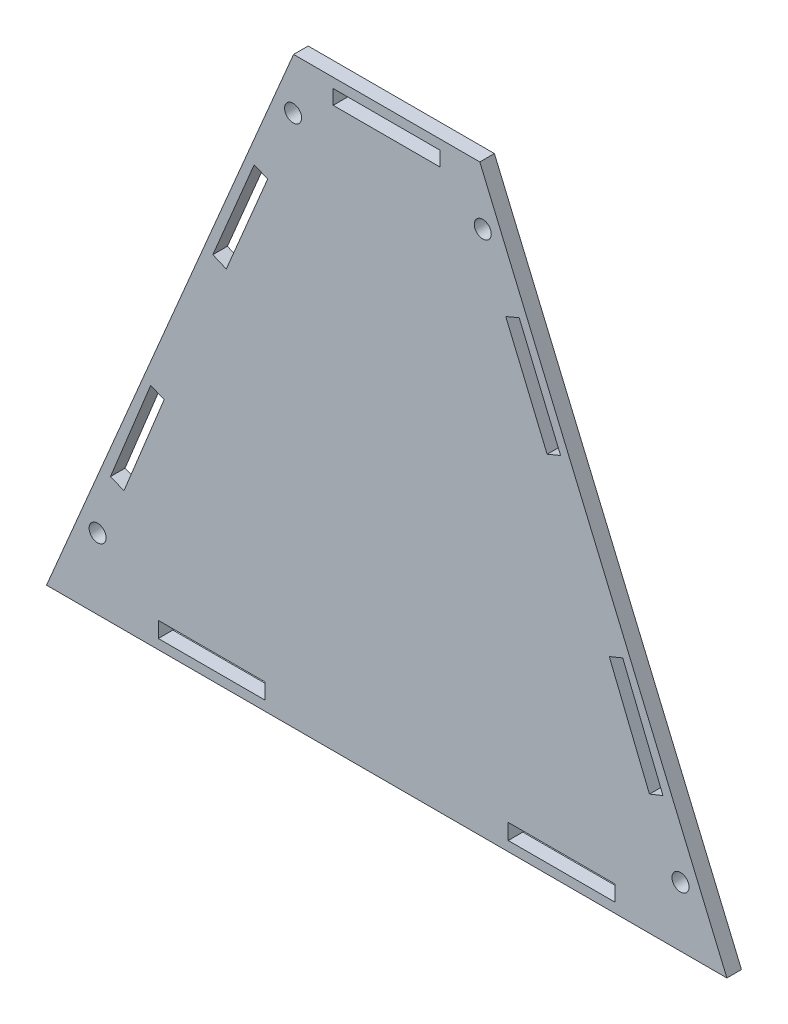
SolidWorks part; units mm, degrees
ref_plane "Front Plane" through (0, 0, 0) normal (0, 0, 1) x (1, 0, 0)
ref_plane "Top Plane" through (0, 0, 0) normal (0, 1, 0) x (1, 0, 0)
ref_plane "Right Plane" through (0, 0, 0) normal (1, 0, 0) x (0, 0, -1)
sketch "Sketch1" plane through (0, 0, 0) normal (0, 0, 1) x (1, 0, 0)
  line L0 (70, 24.2109) -> (70, -66.5) construction
  line L1 (50.8389, 53.5) -> (89.1611, 53.5)
  line L2 (50.8389, 53.5) -> (0, -66.5)
  line L3 (0, -66.5) -> (140, -66.5)
  line L4 (89.1611, 53.5) -> (140, -66.5)
  dimension "D1" = 140
  dimension "D2" = 35
  dimension "D3" = 35
  dimension "D4" = 120
extrude "Boss-Extrude1" add sketch "Sketch1" along normal blind 3
sketch "Sketch2" plane through (0, 0, 0) normal (0, 0, -1) x (-1, 0, 0)
  line L0 (-140, -66.5) -> (-89.1611, 53.5) construction
  line L1 (-50.8389, 53.5) -> (0, -66.5) construction
  circle A0 centre (-130.4513, -54.2153) radius 1.75
  circle A1 centre (-89.764, 41.8229) radius 1.75
  circle A2 centre (-50.736, 43.0033) radius 1.75
  circle A3 centre (-10.5104, -51.9453) radius 1.75
  dimension "D1" = 3.5
  dimension "D2" = 3.5
  dimension "D3" = 3.5
  dimension "D4" = 3.5
  dimension "D5" = 4
  dimension "D6" = 4
  dimension "D7" = 4
  dimension "D8" = 4
extrude "Cut-Extrude1" cut sketch "Sketch2" against normal blind 6
sketch "Sketch4" plane through (0, 0, 0) normal (0, 0, -1) x (-1, 0, 0)
  line L0 (-70, 53.5) -> (-70, 45.1795) construction
  line L1 (-80.9814, 51.5) -> (-58.9814, 51.5)
  line L2 (-80.9814, 51.5) -> (-80.9814, 48.5)
  line L3 (-80.9814, 48.5) -> (-58.9814, 48.5)
  line L4 (-58.9814, 51.5) -> (-58.9814, 48.5)
  line L5 (-89.1611, 53.5) -> (-50.8389, 53.5) construction
  line L6 (-69.9814, 51.5) -> (-69.9814, 48.5) construction
  line L7 (-94.4948, 28.6252) -> (-103.0118, 8.3407)
  line L8 (-115.7892, -21.3141) -> (-124.063, -41.699)
  line L9 (-97.2608, 29.7866) -> (-105.7779, 9.5021)
  line L10 (-118.5689, -20.1858) -> (-126.8428, -40.5707)
  line L11 (-126.8428, -40.5707) -> (-124.063, -41.699)
  line L12 (-118.5689, -20.1858) -> (-115.7892, -21.3141)
  line L13 (-115.7892, -21.3141) -> (-115.8086, -21.3391)
  line L14 (-105.7779, 9.5021) -> (-103.0118, 8.3407)
  line L15 (-97.2608, 29.7866) -> (-94.4948, 28.6252)
  line L16 (-70, 57.0835) -> (-70, -66.5) construction
  line L17 (0, -66.5) -> (-140, -66.5) construction
  line L18 (-13.1572, -40.5707) -> (-15.937, -41.699)
  line L19 (-24.2108, -21.3141) -> (-15.937, -41.699)
  line L20 (-21.4311, -20.1858) -> (-24.2108, -21.3141)
  line L21 (-21.4311, -20.1858) -> (-13.1572, -40.5707)
  line L22 (-34.2221, 9.5021) -> (-36.9882, 8.3407)
  line L23 (-42.7392, 29.7866) -> (-45.5052, 28.6252)
  line L24 (-42.7392, 29.7866) -> (-34.2221, 9.5021)
  line L25 (-45.5052, 28.6252) -> (-36.9882, 8.3407)
  line L26 (-113.5989, -52.6823) -> (-113.5989, -61.0028) construction
  line L27 (-117, -61.2694) -> (-95, -61.2694)
  line L28 (-117, -61.2694) -> (-117, -64.5)
  line L29 (-117, -64.5) -> (-95, -64.5)
  line L30 (-95, -61.2694) -> (-95, -64.5)
  line L31 (-106, -61.2694) -> (-106, -64.5) construction
  line L32 (-140, -66.5) -> (-89.1611, 53.5) construction
  line L33 (-23, -61.2694) -> (-23, -64.5)
  line L34 (-23, -64.5) -> (-45, -64.5)
  line L35 (-23, -61.2694) -> (-45, -61.2694)
  line L36 (-45, -61.2694) -> (-45, -64.5)
  circle A0 centre (-89.764, 41.8229) radius 1.75 construction
  circle A1 centre (-130.4513, -54.2153) radius 1.75 construction
  point P46 (-95, -62.8847)
  dimension "D6" = 14
  dimension "D7" = 14
  dimension "D1" = 22
  dimension "D2" = 3
  dimension "D3" = 22
  dimension "D4" = 22
  dimension "D8" = 2
  dimension "D9" = 2
  dimension "D10" = 2
  dimension "D11" = 25
  dimension "D12" = 22
  dimension "D14" = 25.0586
  dimension "D5" = 3
extrude "Cut-Extrude2" cut sketch "Sketch4" against normal blind 6 contours L35 L36 L34 L33 | L9 L14 L7 L15 | L1 L4 L3 L2 | L25 L22 L24 L23 | L19 L18 L21 L20 | L12 L10 L11 L8 | L27 L30 L29 L28
